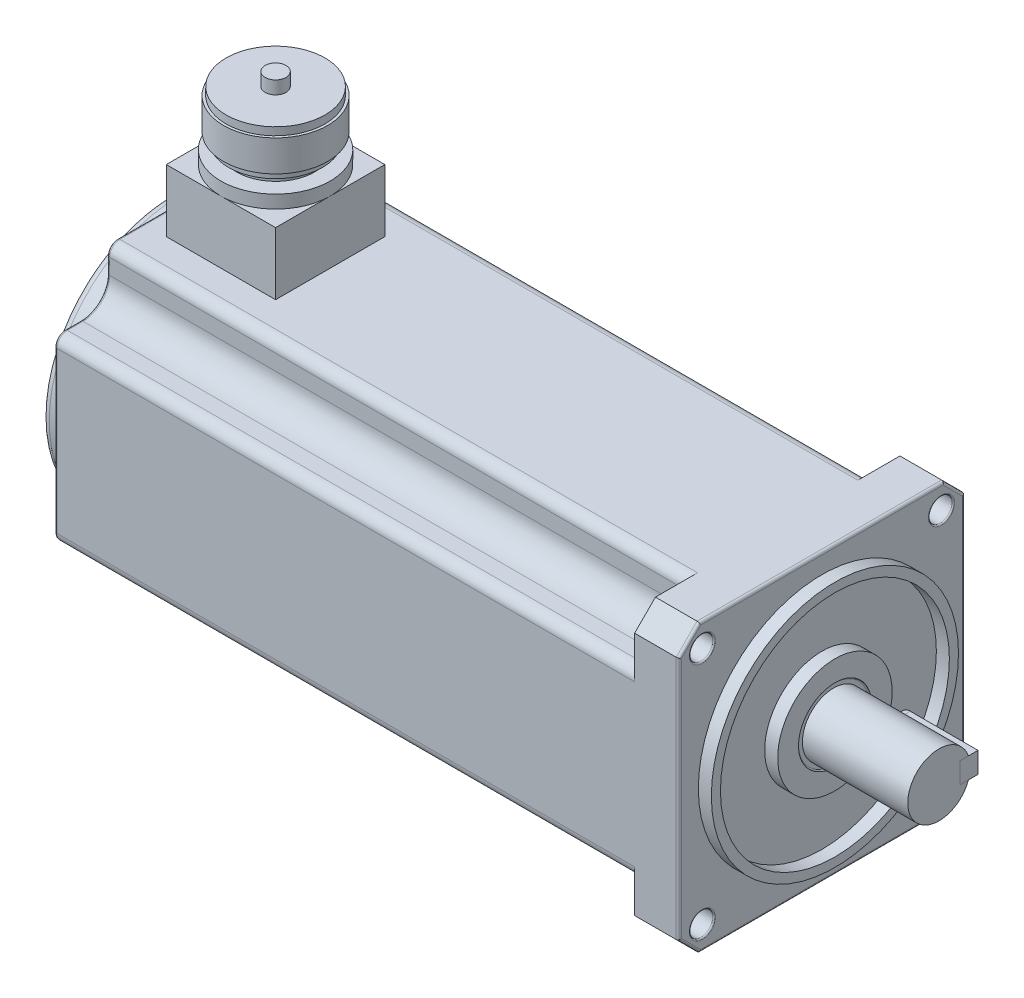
SolidWorks part; units mm, degrees
ref_plane "前视基准面" through (0, 0, 0) normal (0, 0, 1) x (1, 0, 0)
ref_plane "上视基准面" through (0, 0, 0) normal (0, 1, 0) x (1, 0, 0)
ref_plane "右视基准面" through (0, 0, 0) normal (1, 0, 0) x (0, 0, -1)
sketch "草图1" plane through (0, 0, 0) normal (1, 0, 0) x (0, 0, -1)
  line L0 (-55, 47) -> (-47, 55)
  line L1 (-47, -55) -> (47, -55)
  line L2 (-55, -47) -> (-55, 47)
  line L3 (-47, 55) -> (47, 55)
  line L4 (55, -47) -> (55, 47)
  line L5 (-55, -55) -> (55, 55) construction
  line L6 (-55, 55) -> (55, -55) construction
  line L7 (47, 55) -> (55, 47)
  line L8 (47, -55) -> (55, -47)
  line L9 (-55, -47) -> (-47, -55)
  point P0 (0, 0)
extrude "凸台-拉伸1" add sketch "草图1" against normal blind 240
sketch "草图2" plane through (-240, 0, 0) normal (-1, 0, 0) x (0, 0, 1)
  line L0 (-45, 34.802) -> (-51, 34.802)
  line L1 (-55, -47) -> (-55, 47) construction
  line L2 (-30.802, 55) -> (-47, 55)
  line L3 (-51, -34.802) -> (-45, -34.802)
  line L4 (-47, 55) -> (-55, 47)
  line L5 (-34.802, -45) -> (-34.802, -51)
  line L6 (47, -55) -> (-47, -55) construction
  line L7 (-55, 47) -> (-55, 30.802)
  line L8 (34.802, -51) -> (34.802, -45)
  line L9 (-55, -30.802) -> (-55, -47)
  line L10 (45, -34.802) -> (51, -34.802)
  line L11 (55, 47) -> (55, -47) construction
  line L12 (-55, -47) -> (-47, -55)
  line L13 (51, 34.802) -> (45, 34.802)
  line L14 (-47, -55) -> (-30.802, -55)
  line L15 (34.802, 45) -> (34.802, 51)
  line L16 (-47, 55) -> (47, 55) construction
  line L17 (30.802, -55) -> (47, -55)
  line L18 (-34.802, 51) -> (-34.802, 45)
  line L19 (47, -55) -> (55, -47)
  line L20 (55, -47) -> (55, -30.802)
  line L21 (55, 30.802) -> (55, 47)
  line L22 (55, 47) -> (47, 55)
  line L23 (47, 55) -> (30.802, 55)
  arc A0 (-45, 34.802) -> (-34.802, 45) centre (-45, 45) ccw
  arc A1 (34.802, 45) -> (45, 34.802) centre (45, 45) ccw
  arc A2 (45, -34.802) -> (34.802, -45) centre (45, -45) ccw
  arc A3 (-34.802, -45) -> (-45, -34.802) centre (-45, -45) ccw
  arc A4 (-55, -30.802) -> (-51, -34.802) centre (-51, -30.802) ccw
  arc A5 (-34.802, -51) -> (-30.802, -55) centre (-30.802, -51) ccw
  arc A6 (30.802, -55) -> (34.802, -51) centre (30.802, -51) ccw
  arc A7 (55, -30.802) -> (51, -34.802) centre (51, -30.802) cw
  arc A8 (55, 30.802) -> (51, 34.802) centre (51, 30.802) ccw
  arc A9 (34.802, 51) -> (30.802, 55) centre (30.802, 51) ccw
  arc A10 (-30.802, 55) -> (-34.802, 51) centre (-30.802, 51) ccw
  arc A11 (-55, 30.802) -> (-51, 34.802) centre (-51, 30.802) cw
  point P10 (-55, -34.802)
  point P38 (-34.802, -55)
  point P41 (34.802, -55)
  point P44 (55, -34.802)
  point P47 (55, 34.802)
  point P50 (34.802, 55)
  point P53 (-34.802, 55)
  point P56 (-55, 34.802)
  dimension "D1" = 4
extrude "切除-拉伸1" cut sketch "草图2" against normal blind 223
sketch "草图3" plane through (0, 0, 0) normal (1, 0, 0) x (0, 0, -1)
  circle A1 centre (-45.9619, 45.9619) radius 4.5
  circle A2 centre (45.9619, 45.9619) radius 4.5
  circle A3 centre (45.9619, -45.9619) radius 4.5
  circle A4 centre (-45.9619, -45.9619) radius 4.5
extrude "切除-拉伸2" cut sketch "草图3" against normal blind 17
fillet "圆角1" radius 1 24 edges at (-240, 37.7889, 37.7889) (-240, 34.802, 48) (-240, 33.6304, 53.8284) (-240, 0, 55) (-240, -33.6304, 53.8284) (-240, -34.802, 48) (-240, -37.7889, 37.7889) (-240, -48, 34.802) (-240, -53.8284, 33.6304) (-240, -55, 0) (-240, -53.8284, -33.6304) (-240, -48, -34.802) (-240, -37.7889, -37.7889) (-240, -34.802, -48) (-240, -33.6304, -53.8284) (-240, 0, -55) (-240, 33.6304, -53.8284) (-240, 34.802, -48) (-240, 37.7889, -37.7889) (-240, 48, -34.802) (-240, 53.8284, -33.6304) (-240, 55, 0) (-240, 53.8284, 33.6304) (-240, 48, 34.802)
fillet "圆角2" radius 1 8 edges at (0, 51, -51) (0, -51, -51) (0, 0, -55) (0, -55, 0) (0, -51, 51) (0, 0, 55) (0, 51, 51) (0, 55, 0)
fillet "圆角3" radius 0.5 4 edges at (0, -45.9619, 41.4619) (0, -45.9619, -50.4619) (0, 45.9619, -50.4619) (0, 45.9619, 41.4619)
sketch "草图4" plane through (-240, 0, 0) normal (-1, 0, 0) x (0, 0, 1)
  circle A0 centre (0, 0) radius 50
extrude "凸台-拉伸2" add sketch "草图4" along normal blind 10
fillet "圆角4" radius 3 1 edges at (-250, 0, 50)
sketch "草图5" plane through (0, 0, 0) normal (1, 0, 0) x (0, 0, -1)
  circle A0 centre (0, 0) radius 47.5
  circle A1 centre (0, 0) radius 44
extrude "凸台-拉伸3" add sketch "草图5" along normal blind 5
sketch "草图6" plane through (0, 0, 0) normal (1, 0, 0) x (0, 0, -1)
  circle A0 centre (0, 0) radius 22
extrude "凸台-拉伸4" add sketch "草图6" along normal blind 5
sketch "草图7" plane through (5, 0, 0) normal (1, 0, 0) x (0, 0, -1)
  circle A0 centre (0, 0) radius 14
extrude "切除-拉伸3" cut sketch "草图7" against normal blind 0.5
fillet "圆角5" radius 0.5 1 edges at (4.5, 0, -14)
sketch "草图8" plane through (4.5, 0, 0) normal (1, 0, 0) x (0, 0, -1)
  circle A0 centre (0, 0) radius 12
extrude "凸台-拉伸5" add sketch "草图8" along normal blind 40.5
ref_plane "基准面1" through (0, 0, -12) normal (0, 0, 1) x (1, 0, 0)
sketch "草图9" plane through (0, 0, -12) normal (0, 0, 1) x (1, 0, 0)
  line L1 (45, -12) -> (45, 12) construction
  line L2 (19, 4) -> (45, 4)
  line L3 (45, 4) -> (45, -4)
  line L4 (45, -4) -> (19, -4)
  arc A0 (19, 4) -> (19, -4) centre (19, 0) ccw
extrude "切除-拉伸5" cut sketch "草图9" along normal blind 4
sketch "草图10" plane through (0, 0, -8) normal (0, 0, -1) x (-1, 0, 0)
  line L0 (-19, 4) -> (-45, 4)
  line L1 (-45, 4) -> (-45, -4)
  line L2 (-45, -4) -> (-19, -4)
  arc A0 (-19, -4) -> (-19, 4) centre (-19, 0) ccw
extrude "凸台-拉伸6" add sketch "草图10" along normal blind 7 separate body
sketch "草图11" plane through (0, 55, 0) normal (0, 1, 0) x (1, 0, 0)
  line L4 (-231, -21) -> (-189, -21)
  line L5 (-231, -21) -> (-231, 21)
  line L6 (-231, 21) -> (-189, 21)
  line L7 (-189, -21) -> (-189, 21)
  line L8 (-231, -21) -> (-189, 21) construction
  line L9 (-231, 21) -> (-189, -21) construction
extrude "凸台-拉伸7" add sketch "草图11" along normal blind 24
sketch "草图12" plane through (0, 79, 0) normal (0, 1, 0) x (1, 0, 0)
  circle A0 centre (-210, 0) radius 21
extrude "凸台-拉伸8" add sketch "草图12" along normal blind 5
sketch "草图14" plane through (0, 84, 0) normal (0, 1, 0) x (1, 0, 0)
  circle A0 centre (-210, 0) radius 15
extrude "凸台-拉伸9" add sketch "草图14" along normal blind 3
sketch "草图15" plane through (0, 87, 0) normal (0, 1, 0) x (1, 0, 0)
  circle A0 centre (-210, 0) radius 18
extrude "凸台-拉伸10" add sketch "草图15" along normal blind 3
sketch "草图16" plane through (0, 90, 0) normal (0, 1, 0) x (1, 0, 0)
  circle A0 centre (-210, 0) radius 20
extrude "凸台-拉伸11" add sketch "草图16" along normal blind 12
sketch "草图17" plane through (0, 102, 0) normal (0, 1, 0) x (1, 0, 0)
  circle A0 centre (-210, 0) radius 19
extrude "凸台-拉伸12" add sketch "草图17" along normal blind 3
sketch "草图18" plane through (0, 105, 0) normal (0, 1, 0) x (1, 0, 0)
  circle A0 centre (-210, 0) radius 4
extrude "凸台-拉伸13" add sketch "草图18" along normal blind 5
